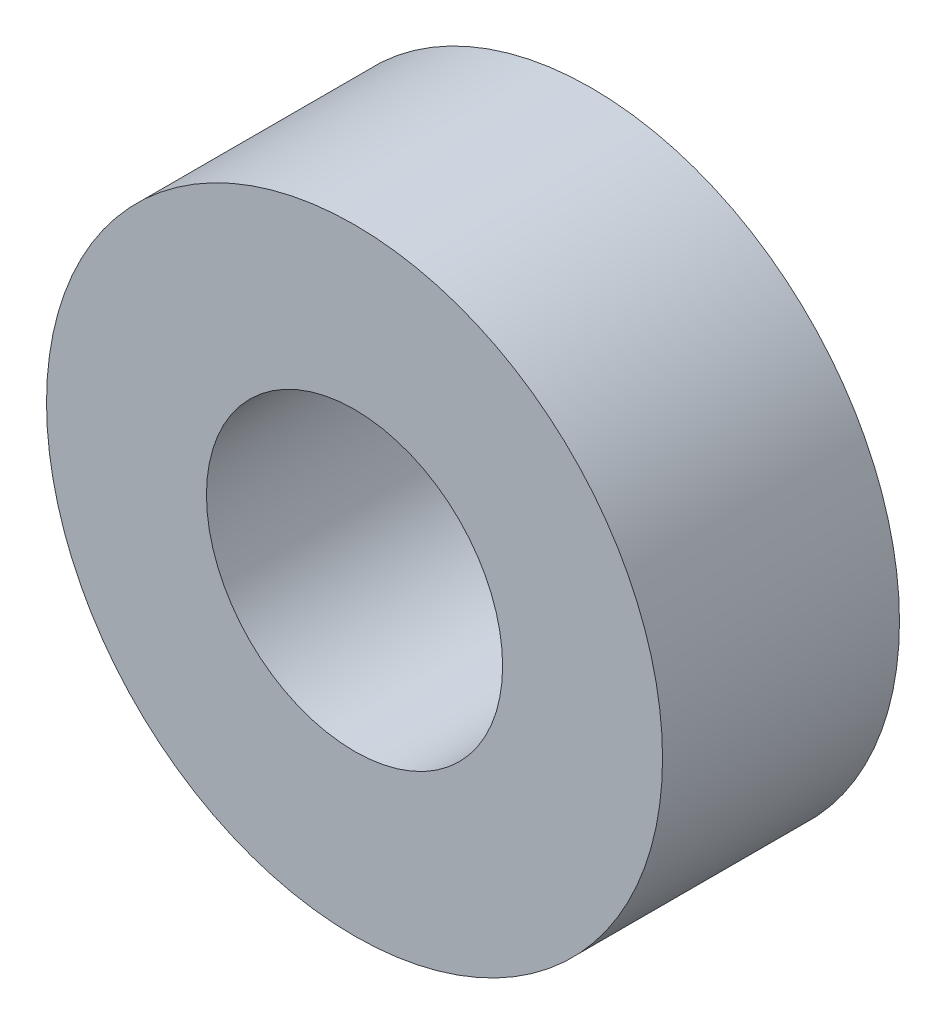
SolidWorks part; units mm, degrees
ref_plane "Piano frontale" through (0, 0, 0) normal (0, 0, 1) x (1, 0, 0)
ref_plane "Piano superiore" through (0, 0, 0) normal (0, 1, 0) x (1, 0, 0)
ref_plane "Piano destro" through (0, 0, 0) normal (1, 0, 0) x (0, 0, -1)
sketch "Schizzo1" plane through (0, 0, 0) normal (0, 0, 1) x (1, 0, 0)
  circle A0 centre (0, 0) radius 26
  circle A1 centre (0, 0) radius 12.5
  dimension "D1" = 25
  dimension "D2" = 52
extrude "Estrusione1" add sketch "Schizzo1" along normal blind 20
fillet "Raccordo1" [suppressed] radius 0.3
ref_plane "Piano1" through (0, 0, 19) normal (0, 0, 1) x (1, 0, 0)
ref_plane "Piano2" through (0, 0, 10) normal (0, 0, 1) x (1, 0, 0)
sketch "Center" plane through (0, 0, 10) normal (0, 0, 1) x (1, 0, 0)
  point P0 (0, 0)
equation "\"D1@Piano2\" = 0.5*\"D1@Estrusione1\""
